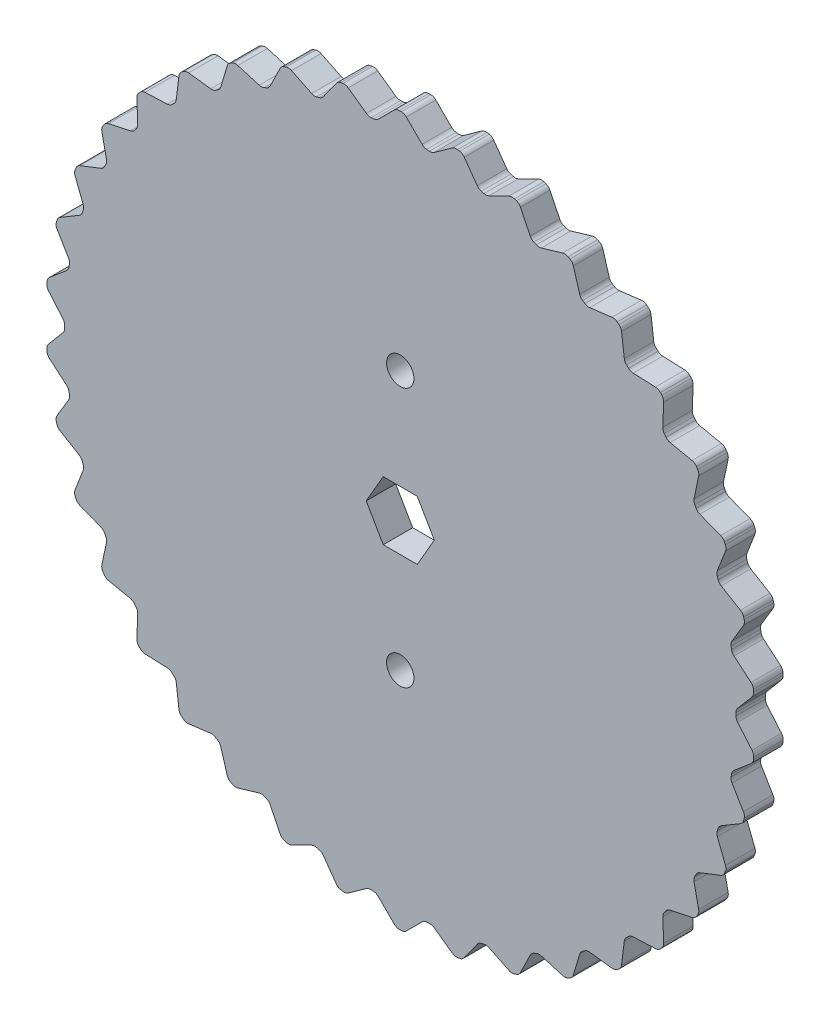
SolidWorks part; units mm, degrees
ref_plane "Front Plane" through (0, 0, 0) normal (0, 0, 1) x (1, 0, 0)
ref_plane "Top Plane" through (0, 0, 0) normal (0, 1, 0) x (1, 0, 0)
ref_plane "Right Plane" through (0, 0, 0) normal (1, 0, 0) x (0, 0, -1)
sketch "Sketch2" plane through (0, 0, 0) normal (0, 0, 1) x (1, 0, 0)
  line L0 (0, 0) -> (0, 44.1565) construction
  line L1 (0, 0) -> (-3.6578, 44.1414) construction
  line L2 (0.4318, 38.1741) -> (-0.4318, 38.1741)
  line L3 (-0.4318, 38.1741) -> (-2.5542, 36.0518)
  line L4 (0.4318, 38.1741) -> (2.5542, 36.0518)
  circle A0 centre (0, 0) radius 36.1421 construction
  arc A1 (-2.5542, 36.0518) -> (-2.9847, 36.0187) centre (0, 0) ccw
  arc A2 (2.5542, 36.0518) -> (2.9847, 36.0187) centre (0, 0) cw
  arc A3 (-2.9847, 36.0187) -> (2.9847, 36.0187) centre (0, 36.1421) ccw
  point P3 (0, 36.1421)
  point P11 (0, 38.1741)
  dimension "D1" = 4.737
  dimension "D5" = 0.4318
  dimension "D2" = 0.4318
  dimension "D3" = 2.032
  dimension "D4" = 45
extrude "Boss-Extrude1" add sketch "Sketch2" along normal blind 3.175
sketch "Sketch3" plane through (0, 0, 0) normal (0, 0, 1) x (1, 0, 0)
  circle A0 centre (0, 0) radius 36.1421
  arc A1 (-2.5542, 36.0518) -> (-2.9847, 36.0187) centre (0, 0) ccw construction
extrude "Boss-Extrude2" add sketch "Sketch3" along normal blind 3.175
fillet "Fillet1" radius 0.762 4 edges at (2.5542, 36.0518, 1.5875) (0.4318, 38.1741, 1.5875) (-0.4318, 38.1741, 1.5875) (-2.5542, 36.0518, 1.5875)
pattern_circular "CirPattern1" count 38 over 360 about axis through (0, 0, 0) along (0, 0, 1) of "Fillet1", "Boss-Extrude1"
sketch "Sketch4" plane through (0, 0, 3.175) normal (0, 0, 1) x (1, 0, 0)
  line L1 (1.8331, -3.175) -> (3.6662, 0)
  line L2 (3.6662, 0) -> (1.8331, 3.175)
  line L3 (1.8331, 3.175) -> (-1.8331, 3.175)
  line L4 (-1.8331, 3.175) -> (-3.6662, 0)
  line L5 (-3.6662, 0) -> (-1.8331, -3.175)
  line L6 (-1.8331, -3.175) -> (1.8331, -3.175)
  circle A0 centre (0, 0) radius 3.175 construction
  dimension "D1" = 6.35
extrude "Cut-Extrude1" cut sketch "Sketch4" against normal through all
hole_wizard "#4 Clearance Hole1" positions "Sketch6" profile "Sketch5" hole size "#4" standard "ANSI Inch"
sketch "Sketch6" plane through (0, 0, 3.175) normal (0, 0, 1) x (1, 0, 0)
  point P0 (0, 13.97)
  point P2 (0, -13.97)
  dimension "D1" = 13.97
  dimension "D2" = 13.97
sketch "Sketch5" plane through (0, 13.97, 3.175) normal (1, 0, 0) x (0, -1, 0)
  line L0 (0, 0) -> (0, 3.175)
  line L1 (0, 3.175) -> (1.4732, 3.175)
  line L2 (1.4732, 3.175) -> (1.4732, 0)
  line L5 (1.4732, 0) -> (0, 0)
  line L11 (0, -6.35) -> (0, 107.95) construction
  dimension "Thru Hole Dia." = 2.9464
  dimension "Thru Hole Depth" = 3.175
